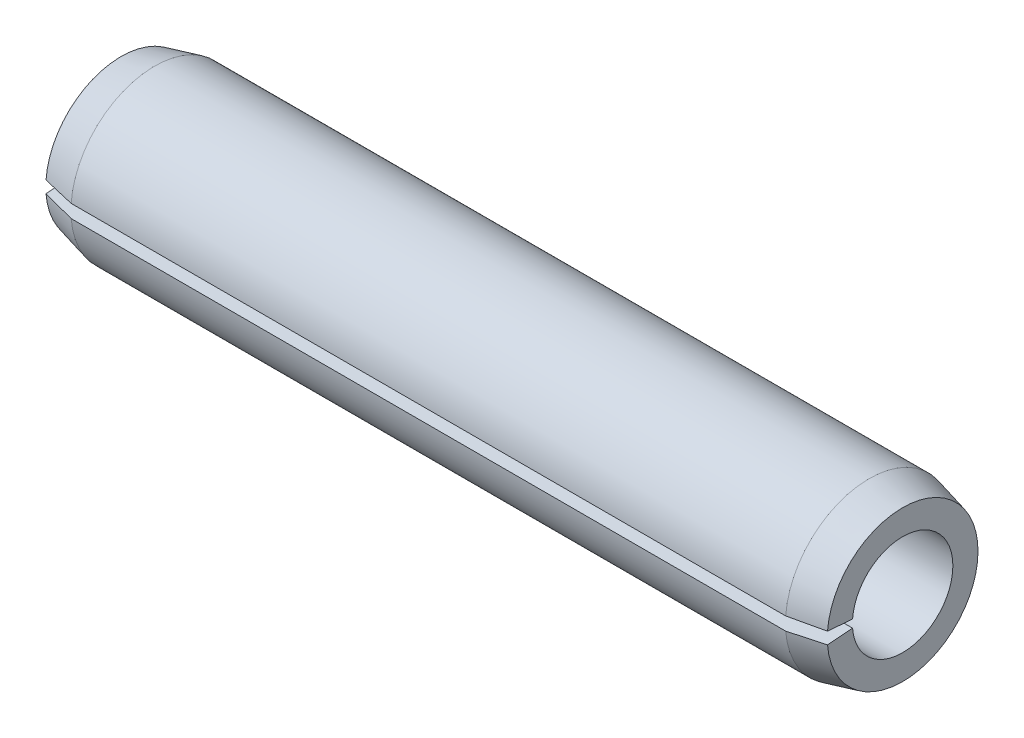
SolidWorks part; units mm, degrees
ref_plane "Plane1" through (0, 0, 0) normal (0, 0, 1) x (1, 0, 0)
ref_plane "Plane2" through (0, 0, 0) normal (0, 1, 0) x (1, 0, 0)
ref_plane "Plane3" through (0, 0, 0) normal (1, 0, 0) x (0, 0, -1)
revolve "Base-Revolve" add sketch "Sketch1" angle 360 about L0
sketch "Sketch1" plane through (0, 0, 0) normal (0, 0, 1) x (1, 0, 0)
  line L0 (-9.525, 0) -> (111.125, 0) construction
  line L1 (0, 1.8) -> (28, 1.8)
  line L2 (28, 1.8) -> (28, 2.7)
  line L3 (28, 2.7) -> (26.8, 3)
  line L4 (26.8, 3) -> (1.2, 3)
  line L5 (1.2, 3) -> (0, 2.7)
  line L7 (0, 2.7) -> (0, 1.8)
  dimension "D1" = 5.4
  dimension "D2" = 5.4
  dimension "Diameter" = 6
  dimension "D3" = 1.2
  dimension "Length" = 28
  dimension "Thickness" = 1.2
  dimension "Chamfer_len" = 1.2
extrude "Gap" cut sketch "Sketch2" against normal through all
sketch "Sketch2" plane through (0, 0, 0) normal (-1, 0, 0) x (0, -1, 0)
  line L0 (0, 0) -> (0.2401, 3.0506)
  line L1 (0, -3.175) -> (0, 12.7) construction
  line L2 (0, 0) -> (-0.2401, 3.0506)
  arc A0 (0.2401, 3.0506) -> (-0.2401, 3.0506) centre (0, 0) ccw
  dimension "D1" = 3.06
  dimension "Gap_ang" = 9
equation "\"D1@Sketch2\" = \"Diameter@Sketch1\" * 0.51"
equation "\"D1@Sketch1\" = \"Diameter@Sketch1\" -  ( \"Thickness@Sketch1\" / 2 ) "
equation "\"D2@Sketch1\" = \"D1@Sketch1\""
equation "\"D3@Sketch1\" = \"Chamfer_len@Sketch1\""
